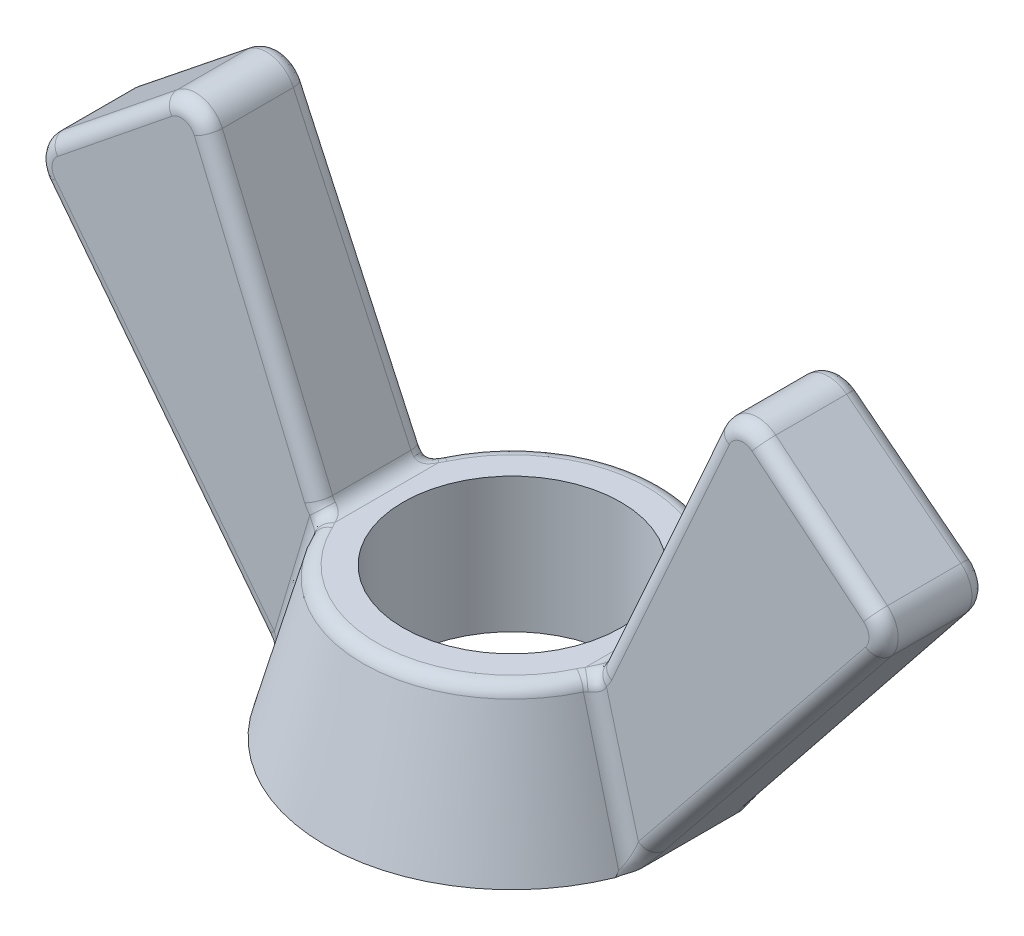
SolidWorks part; units mm, degrees
ref_plane "Front Plane" through (0, 0, 0) normal (0, 0, 1) x (1, 0, 0)
ref_plane "Top Plane" through (0, 0, 0) normal (0, 1, 0) x (1, 0, 0)
ref_plane "Right Plane" through (0, 0, 0) normal (1, 0, 0) x (0, 0, -1)
other "Configuration Table"
sketch "BaseNutSke" plane through (0, 0, 0) normal (0, 0, 1) x (1, 0, 0)
  line L0 (0, 0) -> (-15, 0)
  line L1 (-15, 0) -> (-11.75, 12)
  line L2 (-11.75, 12) -> (0, 12)
  line L3 (0, 12) -> (0, 0)
  line L4 (0, -38.5148) -> (0, 38.5148) construction
revolve "BaseNut" add sketch "BaseNutSke" angle 360 about L4
sketch "BaseWingSke" plane through (0, 0, 0) normal (1, 0, 0) x (0, 0, -1)
  line L0 (0, 0) -> (0, 62.8635) construction
  line L1 (-4, 35) -> (-4.5, 0)
  line L2 (-4, 35) -> (4, 35)
  line L3 (4, 35) -> (4.5, 0)
  line L4 (4.5, 0) -> (-4.5, 0)
  point P8 (0, 35)
  dimension "TopWing_Width" = 8
  dimension "BottomWing_Width" = 9
  dimension "Height" = 35
extrude "BaseWing" add sketch "BaseWingSke" along normal mid plane 68
sketch "CutWingSke" plane through (0, 0, 0) normal (0, 0, 1) x (1, 0, 0)
  line L0 (0, 0) -> (0, 84.5075) construction
  line L1 (-14.3091, 0) -> (-33.4829, 23.8969)
  line L2 (-10.9236, 12) -> (-20.4226, 33.5962)
  line L3 (34, 35) -> (-34, 35) construction
  line L4 (-34, 35) -> (-34, 0) construction
  line L5 (-24.0444, 34.4829) -> (-33.1207, 27.2005)
  line L6 (14.3091, 0) -> (33.4829, 23.8969)
  line L7 (24.0444, 34.4829) -> (33.1207, 27.2005)
  line L8 (10.9236, 12) -> (20.4226, 33.5962)
  line L9 (-14.3091, 0) -> (-34, 0) construction
  line L10 (-44, 45) -> (44, 45)
  line L11 (-44, 45) -> (-44, -10)
  line L12 (-44, -10) -> (44, -10)
  line L13 (44, 45) -> (44, -10)
  line L14 (34, 35) -> (34, 0) construction
  line L15 (-10.9236, 12) -> (10.9236, 12)
  line L16 (14.3091, 0) -> (-14.3091, 0)
  arc A0 (-20.4226, 33.5962) -> (-24.0444, 34.4829) centre (-22.5737, 32.65) ccw
  arc A1 (-33.4829, 23.8969) -> (-33.1207, 27.2005) centre (-31.65, 25.3676) cw
  arc A2 (33.4829, 23.8969) -> (33.1207, 27.2005) centre (31.65, 25.3676) ccw
  arc A3 (20.4226, 33.5962) -> (24.0444, 34.4829) centre (22.5737, 32.65) cw
extrude "CutWing" cut sketch "CutWingSke" against normal mid plane 68
sketch "HoleSke" plane through (0, 0, 0) normal (0, 1, 0) x (1, 0, 0)
  circle A0 centre (0, 0) radius 8.75
extrude "TappedHole" cut sketch "HoleSke" along normal through all
chamfer "Chamfer1" distance 1.1667 angle 60 1 edges at (0, 0, 8.75)
sketch "ThdSchSke" plane through (0, 0, 0) normal (0, 0, 1) x (1, 0, 0)
  line L0 (8.75, 1.1667) -> (7.3066, 1.1667)
  line L1 (7.3066, 1.1667) -> (7.3066, 2.61)
  line L2 (7.3066, 2.61) -> (8.75, 2.61)
  line L3 (8.75, 2.61) -> (10, 1.8884)
  line L4 (10, 1.8884) -> (8.75, 1.1667)
  line L5 (0, -3.4614) -> (0, 8.4929) construction
  line L6 (-8.75, 1.1667) -> (8.75, 1.1667) construction
revolve "ThreadSchematic" [suppressed] cut sketch "ThdSchSke" angle 360 about L5
pattern_linear "ThdSchPat" [suppressed]
fillet "Fillet1" radius 1.3056 6 edges at (10.9236, 12, 0) (-10.9236, 12, 0)
fillet "Fillet2" radius 1.175 38 edges at (-14.6132, 0.3791, 4.6115) (-24.2551, 12.396, 4.3229) (-15.9429, 23.4115, 4.1655) (-33.986, 25.6237, 4.1339) (-33.986, 25.6237, -4.1339) (-14.6196, 0.387, -4.6077) (-24.2551, 12.396, -4.3229) (-15.9429, 23.4115, -4.1655) (14.6132, 0.3791, -4.6115) (24.2551, 12.396, -4.3229) (33.986, 25.6237, -4.1339) (28.5825, 30.8417, -4.0594) (22.0148, 34.9326, -4.001) (-28.5825, 30.8417, -4.0594) (-22.0148, 34.9326, -4.001) (-10.8692, 12.2719, -4.6314) (0, 12, 11.75) (0, 12, -11.75) (10.9957, 12.3833, -4.5188) (-28.5825, 30.8417, 4.0594) (-22.0148, 34.9326, 4.001) (14.6196, 0.387, 4.6077) (24.2551, 12.396, 4.3229) (33.986, 25.6237, 4.1339) (28.5825, 30.8417, 4.0594) (22.0148, 34.9326, 4.001) (15.9429, 23.4115, 4.1655) (10.8692, 12.2719, 4.6314) (-10.9957, 12.3833, 4.5188) (15.9429, 23.4115, -4.1655)
equation "\"D1@CutWing\" = \"Width@BaseWing\""
equation "\"D5@CutWingSke\" = \"Top_Width@BaseNutSke\"/10"
equation "\"D1@Chamfer1\" = \"Tap_drill@HoleSke\"/15"
equation "\"D1@ThdSchSke\" = \"Tap_drill@HoleSke\""
equation "\"ThreadN@ThdSchSke\" = \"Thread_major@ThreadCosmetic\""
equation "\"Num_threads@ThdSchPat\" = int( \"Nut_Height@BaseNutSke\"/\"Advance@ThdSchPat\" ) +1"
equation "\"D1@Fillet1\" =\"Top_Width@BaseNutSke\"/18"
equation "\"D1@Fillet2\" = \"Top_Width@BaseNutSke\"/20"
